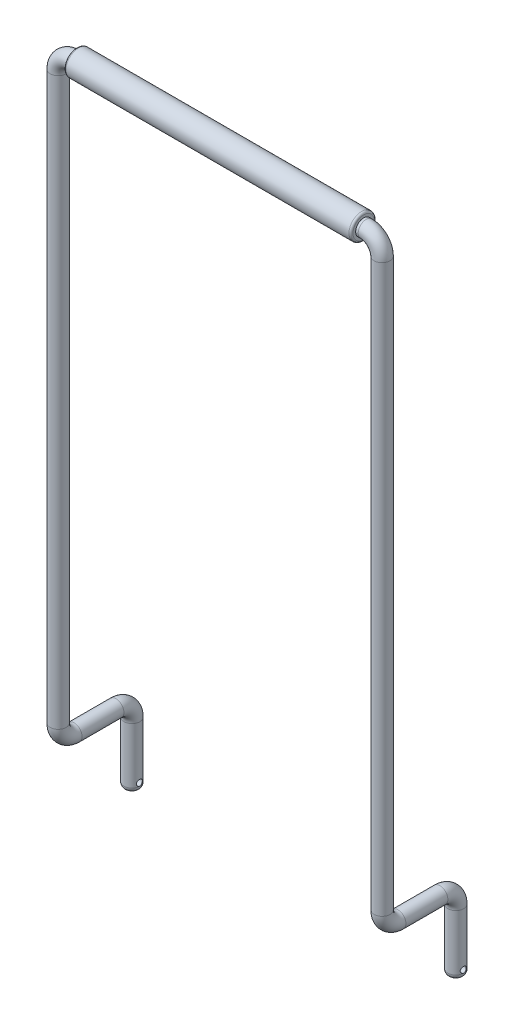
SolidWorks part; units mm, degrees
ref_plane "Front Plane" through (0, 0, 0) normal (0, 0, 1) x (1, 0, 0)
ref_plane "Top Plane" through (0, 0, 0) normal (0, 1, 0) x (1, 0, 0)
ref_plane "Right Plane" through (0, 0, 0) normal (1, 0, 0) x (0, 0, -1)
sketch "Sketch1" plane through (0, 0, 0) normal (0, 0, 1) x (1, 0, 0)
  line L0 (0, 0) -> (-73.25, 0)
  line L1 (-81.25, -8) -> (-81.25, -275)
  arc A0 (-81.25, -8) -> (-73.25, 0) centre (-73.25, -8) cw
  point P6 (-81.25, 0)
  dimension "D3" = 8
  dimension "D1" = 81.25
  dimension "D2" = 275
sketch "Sketch2" plane through (0, 0, 0) normal (1, 0, 0) x (0, 0, -1)
  circle A0 centre (0, 0) radius 4
  dimension "D1" = 8
sweep "Sweep1" add profiles "Sketch2" path "Sketch1"
ref_plane "Plane1" through (-81.25, 0, 0) normal (1, 0, 0) x (0, 0, -1)
sketch "Sketch3" plane through (-81.25, 0, 0) normal (1, 0, 0) x (0, 0, -1)
  line L0 (0, -275) -> (0, -292)
  line L1 (-4, -275) -> (4, -275) construction
  line L2 (0, -8) -> (0, -275) construction
  line L3 (8, -300) -> (26, -300)
  arc A0 (0, -292) -> (8, -300) centre (8, -292) ccw
  point P11 (0, -300)
  dimension "D3" = 8
  dimension "D1" = 25
  dimension "D2" = 26
ref_plane "Plane2" through (0, 0, -26) normal (0, 0, 1) x (1, 0, 0)
sketch "Sketch4" plane through (0, 0, -26) normal (0, 0, 1) x (1, 0, 0)
  circle A0 centre (-81.25, -300) radius 4
  dimension "D1" = 8
sweep "Sweep2" add profiles "Sketch4" path "Sketch3"
sketch "Sketch7" plane through (-81.25, 0, 0) normal (1, 0, 0) x (0, 0, -1)
  line L0 (26, -300) -> (29, -300)
  line L1 (26, -304) -> (26, -296) construction
  line L2 (8, -300) -> (26, -300) construction
  line L3 (37, -308) -> (37, -338.5)
  arc A0 (29, -300) -> (37, -308) centre (29, -308) cw
  point P9 (37, -300)
  dimension "D3" = 8
  dimension "D1" = 11
  dimension "D2" = 38.5
sketch "Sketch8" plane through (0, 0, -26) normal (0, 0, -1) x (-1, 0, 0)
  circle A1 centre (81.25, -300) radius 4
  circle A2 centre (81.25, -300) radius 4
  dimension "D1" = 0
sweep "Sweep3" add profiles "Sketch8" path "Sketch7"
mirror "Mirror1" about plane through (0, 0, 0) normal (1, 0, 0) of "Sweep1", "Sweep2", "Sweep3"
sketch "Sketch5" plane through (0, 0, 0) normal (1, 0, 0) x (0, 0, -1)
  circle A0 centre (0, 0) radius 6.35
  dimension "D1" = 12.7
extrude "Boss-Extrude1" add sketch "Sketch5" along normal mid plane 144 separate body
sketch "Sketch6" plane through (-81.25, 0, 0) normal (1, 0, 0) x (0, 0, -1)
  line L2 (37, -308) -> (37, -338.5) construction
  line L4 (33, -338.5) -> (41, -338.5) construction
  circle A0 centre (37, -334.5) radius 1.5
  dimension "D1" = 3
  dimension "D2" = 4
extrude "Cut-Extrude1" cut sketch "Sketch6" against normal through all both and the other way through all
fillet "Fillet1" radius 1 2 edges at (72, 0, -6.35) (-72, 0, -6.35)
fillet "Fillet2" radius 2.5 2 edges at (85.25, -338.5, -37) (-85.25, -338.5, -37)
